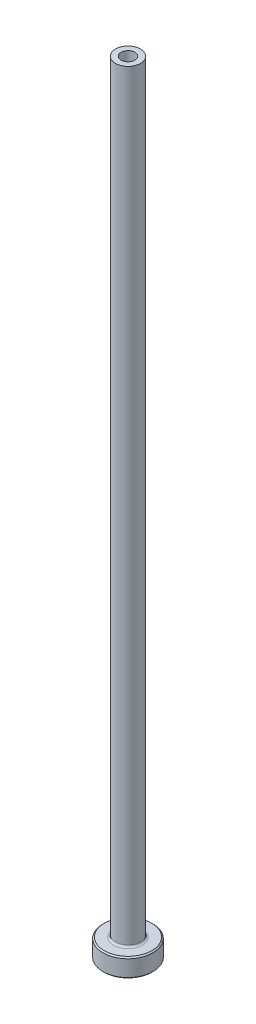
SolidWorks part; units mm, degrees
ref_plane "Front Plane" through (0, 0, 0) normal (0, 0, 1) x (1, 0, 0)
ref_plane "Top Plane" through (0, 0, 0) normal (0, 1, 0) x (1, 0, 0)
ref_plane "Right Plane" through (0, 0, 0) normal (1, 0, 0) x (0, 0, -1)
sketch "Sketch1" plane through (0, 0, 0) normal (0, 0, 1) x (1, 0, 0)
  line L0 (-1.1, 125) -> (-2, 125)
  line L1 (-2, 125) -> (-2, 3)
  line L2 (-2, 3) -> (-4, 3)
  line L3 (-4, 3) -> (-4, 0)
  line L4 (4.4, 0) -> (-4.4, 0) construction
  line L5 (-4, 0) -> (-1.35, 0)
  line L6 (-1.1, 90) -> (-1.1, 125)
  line L7 (0, 92.1877) -> (0, -15.5353) construction
  line L8 (0, -4.4) -> (0, 4.4) construction
  line L9 (-1.1, 90) -> (-1.35, 78)
  line L10 (-1.35, 78) -> (-1.35, 0)
  dimension "D1" = 0.25
  dimension "ID" = 2.2
  dimension "OD" = 4
  dimension "L" = 125
  dimension "H" = 8
  dimension "T" = 3
  dimension "N" = 35
  dimension "D2" = 12
revolve "Revolve1" add sketch "Sketch1" angle 360 about L7
fillet "Fillet1" radius 0.3 1 edges at (0, 3, 2)
chamfer "Chamfer1" distance 0.2 angle 45 2 edges at (0, 3, 4) (0, 0, 4)
chamfer "Chamfer3" distance 0.5 angle 45 1 edges at (0, 0, 1.35)
